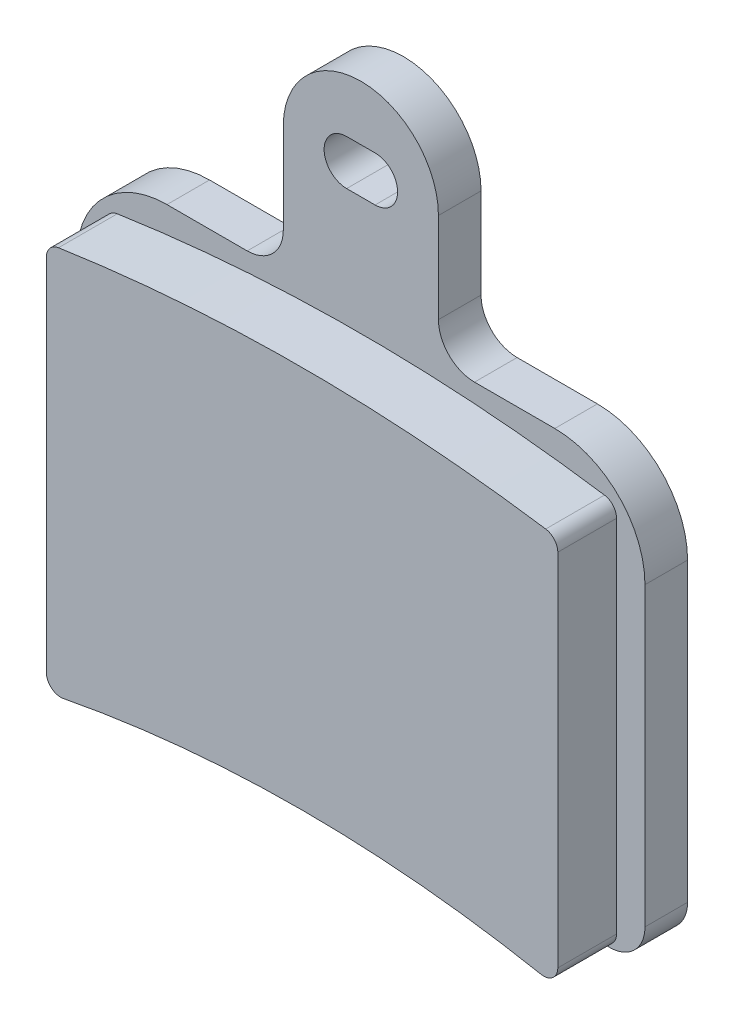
SolidWorks part; units mm, degrees
ref_plane "Front Plane" through (0, 0, 0) normal (0, 0, 1) x (1, 0, 0)
ref_plane "Top Plane" through (0, 0, 0) normal (0, 1, 0) x (1, 0, 0)
ref_plane "Right Plane" through (0, 0, 0) normal (1, 0, 0) x (0, 0, -1)
sketch "Sketch1" plane through (0, 0, 0) normal (0, 0, 1) x (1, 0, 0)
  line L6 (-5.461, -2.8383) -> (-5.461, -10.16)
  line L7 (-8.001, -12.7) -> (-13.6525, -12.7)
  line L8 (-20.0025, -19.05) -> (-20.0025, -37.0481)
  line L9 (20.0025, -37.0481) -> (20.0025, -19.05)
  line L10 (13.6525, -12.7) -> (8.001, -12.7)
  line L11 (5.461, -10.16) -> (5.461, -2.8383)
  line L12 (-5.461, -3.81) -> (-5.461, -10.16)
  line L13 (-8.001, -12.7) -> (-13.6525, -12.7)
  line L14 (-20.0025, -19.05) -> (-20.0025, -39.9152)
  line L15 (20.0025, -39.9151) -> (20.0025, -19.05)
  line L16 (13.6525, -12.7) -> (8.001, -12.7)
  line L17 (5.461, -10.16) -> (5.461, -3.81)
  arc A0 (19.685, -42.9304) -> (-12.7975, -41.6497) centre (0.0002, -129.6237) ccw construction
  arc A1 (17.0238, -42.3688) -> (-17.0238, -42.3689) centre (0.0002, -129.6237) ccw
  arc A2 (-20.0025, -39.9152) -> (-17.0238, -42.3689) centre (-17.5025, -39.9152) ccw
  arc A3 (20.0025, -39.9151) -> (17.0238, -42.3688) centre (17.5025, -39.9151) cw
  arc A4 (-5.461, -3.81) -> (5.461, -3.81) centre (0, -3.81) cw
  arc A10 (-8.001, -12.7) -> (-5.461, -10.16) centre (-8.001, -10.16) ccw
  arc A11 (-13.6525, -12.7) -> (-20.0025, -19.05) centre (-13.6525, -19.05) ccw
  arc A12 (-21.0135, -37.5598) -> (-20.0025, -37.0481) centre (-20.6375, -37.0481) ccw
  arc A13 (-21.0135, -37.5598) -> (21.0135, -37.5598) centre (0, -8.9618) ccw
  arc A14 (20.0025, -37.0481) -> (21.0135, -37.5598) centre (20.6375, -37.0481) ccw
  arc A15 (20.0025, -19.05) -> (13.6525, -12.7) centre (13.6525, -19.05) ccw
  arc A16 (5.461, -10.16) -> (8.001, -12.7) centre (8.001, -10.16) ccw
  arc A17 (8.1901, -0.3054) -> (5.461, -2.8383) centre (8.001, -2.8383) ccw
  arc A18 (8.1901, -0.3054) -> (-8.1901, -0.3054) centre (0, -109.982) ccw
  arc A19 (-5.461, -2.8383) -> (-8.1901, -0.3054) centre (-8.001, -2.8383) ccw
  arc A20 (-8.001, -12.7) -> (-5.461, -10.16) centre (-8.001, -10.16) ccw
  arc A21 (-13.6525, -12.7) -> (-20.0025, -19.05) centre (-13.6525, -19.05) ccw
  arc A25 (20.0025, -19.05) -> (13.6525, -12.7) centre (13.6525, -19.05) ccw
  arc A26 (5.461, -10.16) -> (8.001, -12.7) centre (8.001, -10.16) ccw
  dimension "D2" = 2.5
  dimension "D1" = 0
extrude "Boss-Extrude1" add sketch "Sketch1" along normal blind 3
sketch "Sketch3" plane through (0, 0, 3) normal (0, 0, 1) x (1, 0, 0)
  line L0 (-1, -3.81) -> (1, -3.81) construction
  line L1 (-1, -2.2225) -> (1, -2.2225)
  line L2 (-1, -5.3975) -> (1, -5.3975)
  circle A0 centre (0, -3.81) radius 1.5875 construction
  circle A1 centre (0, -3.81) radius 1.5875 construction
  arc A2 (-1, -2.2225) -> (-1, -5.3975) centre (-1, -3.81) ccw
  arc A3 (1, -5.3975) -> (1, -2.2225) centre (1, -3.81) ccw
  point P5 (0, -3.81)
  dimension "D1" = 2
extrude "Cut-Extrude1" cut sketch "Sketch3" against normal through all
sketch "Sketch2" plane through (0, 0, 3) normal (0, 0, 1) x (1, 0, 0)
  line L2 (-18.0025, -37.0481) -> (-18.0025, -19.05)
  line L4 (-18.0025, -41.3462) -> (-18.0025, -16.0013)
  line L6 (18.0025, -19.05) -> (18.0025, -37.0481)
  line L7 (18.0025, -16.0012) -> (18.0025, -41.3461)
  arc A0 (17.0238, -42.3688) -> (-17.0238, -42.3689) centre (0.0002, -129.6237) ccw construction
  arc A1 (16.8134, -42.328) -> (-16.8134, -42.3281) centre (0.0002, -129.6237) ccw
  circle A2 centre (0.0002, -129.6237) radius 115.8875 construction
  arc A3 (17.1505, -15.0122) -> (-17.1505, -15.0123) centre (0.0002, -129.6237) ccw
  arc A4 (-18.0025, -41.3462) -> (-16.8134, -42.3281) centre (-17.0025, -41.3462) ccw
  arc A5 (18.0025, -41.3461) -> (16.8134, -42.328) centre (17.0025, -41.3461) cw
  arc A6 (17.1505, -15.0122) -> (18.0025, -16.0012) centre (17.0025, -16.0012) cw
  arc A7 (-17.1505, -15.0123) -> (-18.0025, -16.0013) centre (-17.0025, -16.0013) ccw
  dimension "D3" = 1
  dimension "D4" = 1
  dimension "D1" = 2
  dimension "D2" = 2
extrude "Boss-Extrude2" add sketch "Sketch2" along normal offset from surface (4.1358 mm away) 1.5 separate body
